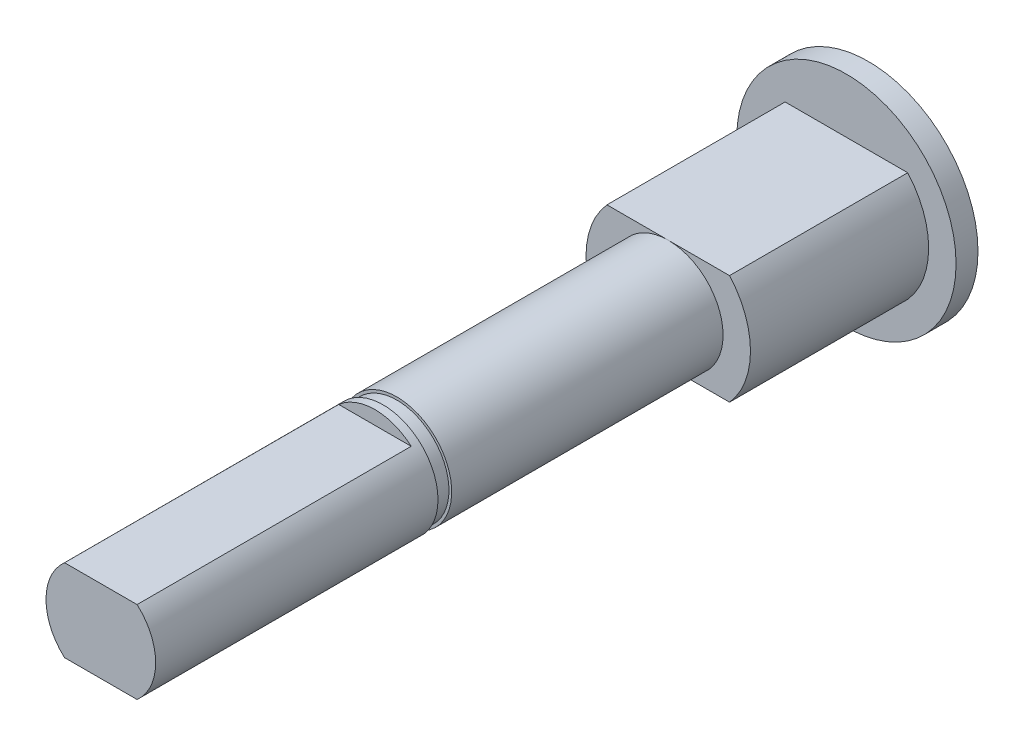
SolidWorks part; units mm, degrees
ref_plane "Plan de face" through (0, 0, 0) normal (0, 0, 1) x (1, 0, 0)
ref_plane "Plan de dessus" through (0, 0, 0) normal (0, 1, 0) x (1, 0, 0)
ref_plane "Plan de droite" through (0, 0, 0) normal (1, 0, 0) x (0, 0, -1)
sketch "Esquisse1" plane through (0, 0, 0) normal (0, 0, 1) x (1, 0, 0)
  line L0 (-2.2361, 2) -> (2.2361, 2)
  line L1 (-2.2361, -2) -> (2.2361, -2)
  arc A0 (-2.2361, 2) -> (-2.2361, -2) centre (0, 0) ccw
  arc A1 (2.2361, -2) -> (2.2361, 2) centre (0, 0) ccw
  dimension "D1" = 6
  dimension "D2" = 4
  dimension "D3" = 2
extrude "Extrusion1" add sketch "Esquisse1" along normal blind 6.5
sketch "Esquisse2" plane through (0, 0, 0) normal (0, 0, -1) x (-1, 0, 0)
  circle A0 centre (0, 0) radius 4
  dimension "D1" = 8
extrude "Extrusion2" add sketch "Esquisse2" along normal blind 0.8
sketch "Esquisse3" plane through (0, 0, 6.5) normal (0, 0, 1) x (1, 0, 0)
  circle A0 centre (0, 0) radius 2
  dimension "D1" = 4
extrude "Extrusion3" add sketch "Esquisse3" along normal blind 10.7
sketch "Esquisse4" plane through (0, 0, 0) normal (1, 0, 0) x (0, 0, -1)
  line L0 (-6.5, 2) -> (-6.5, -2) construction
  line L1 (-16.9, 2.4893) -> (-16.4, 2.4893)
  line L2 (-16.9, 2.4893) -> (-16.9, 1.9)
  line L3 (-16.9, 1.9) -> (-16.4, 1.9)
  line L4 (-16.4, 2.4893) -> (-16.4, 1.9)
  line L5 (0, 0) -> (-17.7059, 0) construction
  dimension "D1" = 10.4
  dimension "D2" = 0.5
  dimension "D3" = 1.9
revolve "Enlèvement de matière-Révolution1" cut sketch "Esquisse4" angle 360 about L5
sketch "Esquisse5" plane through (0, 0, 17.2) normal (0, 0, 1) x (1, 0, 0)
  line L0 (-1.3229, 1.5) -> (1.3229, 1.5)
  line L1 (-1.3229, -1.5) -> (1.3229, -1.5)
  arc A0 (-1.3229, 1.5) -> (-1.3229, -1.5) centre (0, 0) ccw
  arc A1 (1.3229, -1.5) -> (1.3229, 1.5) centre (0, 0) ccw
  dimension "D1" = 4
  dimension "D2" = 3
  dimension "D3" = 1.5
extrude "Extrusion4" add sketch "Esquisse5" along normal blind 10
